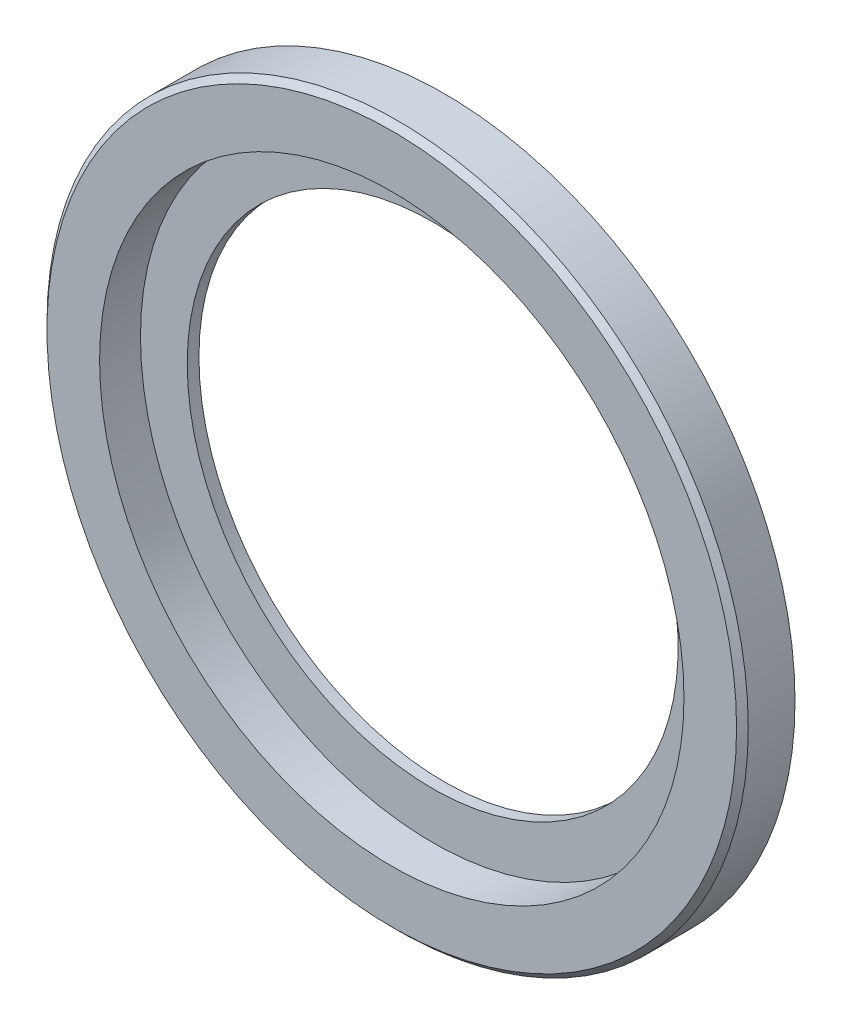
SolidWorks part; units mm, degrees
ref_plane "前视基准面" through (0, 0, 0) normal (0, 0, 1) x (1, 0, 0)
ref_plane "上视基准面" through (0, 0, 0) normal (0, 1, 0) x (1, 0, 0)
ref_plane "右视基准面" through (0, 0, 0) normal (1, 0, 0) x (0, 0, -1)
other "Configuration Table"
sketch "草图1" plane through (0, 0, 0) normal (0, 0, 1) x (1, 0, 0)
  circle A0 centre (0, 0) radius 60
  dimension "D1" = 120
extrude "凸台-拉伸2" add sketch "草图1" along normal blind 9
sketch "草图3" plane through (0, 0, 9) normal (0, 0, 1) x (1, 0, 0)
  circle A0 centre (0, 0) radius 50
  dimension "D1" = 100
extrude "切除-拉伸3" cut sketch "草图3" against normal blind 7
sketch "草图4" plane through (0, 0, 0) normal (0, 0, -1) x (-1, 0, 0)
  circle A0 centre (0, 0) radius 42
  dimension "D1" = 84
extrude "切除-拉伸4" cut sketch "草图4" against normal blind 2
chamfer "倒角1" distance 1 angle 45 1 edges at (60, 0, 9)
sketch "草图5" plane through (0, 0, 0) normal (0, 0, -1) x (-1, 0, 0)
  circle A0 centre (0, 0) radius 54 construction
  point P4 (0, 54)
  dimension "D1" = 108
hole_wizard "Ø5.0mm 暗销孔1" positions "草图5" profile "草图6" hole size "Ø5.0" standard "GB"
sketch "草图6" plane through (0, 54, 0) normal (1, 0, 0) x (0, 1, 0)
  line L0 (0, 0) -> (0, 7.5022)
  line L1 (0, 7.5022) -> (2.5, 6)
  line L2 (2.5, 6) -> (2.5, 0.025)
  line L3 (2.5, 0.025) -> (2.525, 0)
  line L5 (2.525, 0) -> (0, 0)
  line L6 (-2.5, 0.025) -> (-2.525, 0) construction
  line L10 (0, 7.5022) -> (-2.5, 6) construction
  line L11 (0, -6.35) -> (0, 107.95) construction
  dimension "孔直径" = 5
  dimension "孔深度" = 6
  dimension "近端锥形沉头孔直径" = 5.05
  dimension "近端锥形沉头孔角度" = 90
  dimension "导头角度" = 118
pattern_circular "阵列(圆周)1" count 8 over 360 about axis through (0, 0, 0) along (0, 0, 1) of "Ø5.0mm 暗销孔1"
